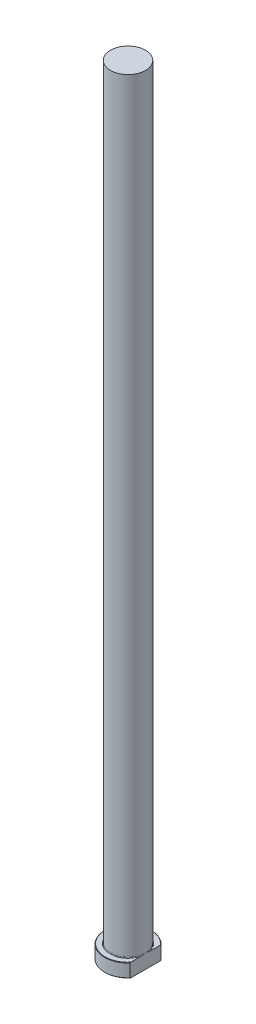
SolidWorks part; units mm, degrees
ref_plane "Front Plane" through (0, 0, 0) normal (0, 0, 1) x (1, 0, 0)
ref_plane "Top Plane" through (0, 0, 0) normal (0, 1, 0) x (1, 0, 0)
ref_plane "Right Plane" through (0, 0, 0) normal (1, 0, 0) x (0, 0, -1)
sketch "Sketch1" plane through (0, 0, 0) normal (0, 0, 1) x (1, 0, 0)
  line L0 (0, 259.9588) -> (0, -15.1925) construction
  line L1 (0, 0) -> (-12, 0)
  line L2 (-12, 0) -> (-12, 7)
  line L3 (-12, 7) -> (-9, 7)
  line L4 (-9, 7) -> (-9, 400)
  line L5 (-9, 400) -> (0, 400)
  line L6 (0, 400) -> (0, 0)
  dimension "L" = 400
  dimension "H" = 24
  dimension "T" = 7
  dimension "D" = 18
revolve "Revolve1" add sketch "Sketch1" angle 360 about L0
chamfer "Chamfer1" distance 0.2 angle 45 2 edges at (0, 7, 12) (0, 0, 12)
fillet "Fillet1" radius 0.3 1 edges at (0, 7, 9)
sketch "Sketch2" plane through (0, 0, 0) normal (0, 1, 0) x (1, 0, 0)
  line L0 (9, 7.9373) -> (9, -7.9373)
  circle A0 centre (0, 0) radius 12 construction
  arc A1 (9, -7.9373) -> (9, 7.9373) centre (0, 0) ccw
  circle A2 centre (0, 0) radius 9 construction
extrude "KEY" cut sketch "Sketch2" along normal through all
